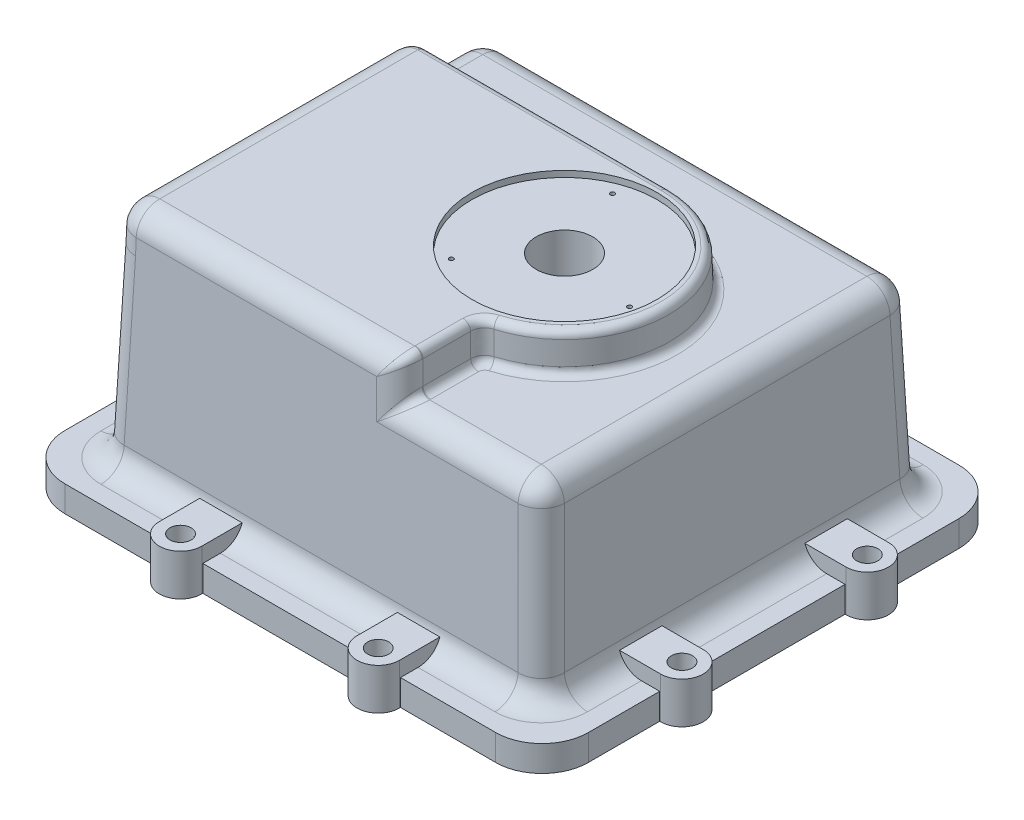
SolidWorks part; units mm, degrees
ref_plane "Front Plane" through (0, 0, 0) normal (0, 0, 1) x (1, 0, 0)
ref_plane "Bottom Plane" through (0, 0, 0) normal (0, 1, 0) x (1, 0, 0)
ref_plane "Right Plane" through (0, 0, 0) normal (1, 0, 0) x (0, 0, -1)
ref_plane "Top Plane" through (0, 109.9058, 0) normal (0, 1, 0) x (-1, 0, 0)
sketch "Sketch1" plane through (0, 0, 0) normal (0, 1, 0) x (1, 0, 0)
  line L0 (0, -56.5506) -> (0, 56.5506) construction
  line L1 (-91.1885, 79.1743) -> (91.1885, 79.1743)
  line L2 (-91.1885, 79.1743) -> (-91.1885, -79.1743)
  line L3 (-91.1885, -79.1743) -> (91.1885, -79.1743)
  line L4 (91.1885, 79.1743) -> (91.1885, -79.1743)
  line L5 (0, 125.2267) -> (0, -103.1293) construction
  line L6 (-125.0717, 0) -> (114.8319, 0) construction
  line L7 (-56.5506, 0) -> (56.5506, 0) construction
  point P12 (0, 79.1743)
  point P13 (-91.1885, 0)
  dimension "D1" = 182.3771
  dimension "D2" = 158.3487
extrude "BODY EXTRUDE" add sketch "Sketch1" along normal blind 87.249 draft 2
sketch "Sketch2" plane through (0, 0, 0) normal (0, 1, 0) x (1, 0, 0)
  line L0 (0, -110.293) -> (0, 116.7303) construction
  line L1 (-88.519, -95.2246) -> (88.519, -95.2246)
  line L2 (-107.569, -76.1746) -> (-107.569, 76.1746)
  line L3 (-88.519, 95.2246) -> (88.519, 95.2246)
  line L4 (107.569, -76.1746) -> (107.569, 76.1746)
  line L5 (0, 0) -> (131.7508, 0) construction
  arc A0 (-88.519, -95.2246) -> (-107.569, -76.1746) centre (-88.519, -76.1746) cw
  arc A1 (107.569, -76.1746) -> (88.519, -95.2246) centre (88.519, -76.1746) cw
  arc A2 (88.519, 95.2246) -> (107.569, 76.1746) centre (88.519, 76.1746) cw
  arc A3 (-88.519, 95.2246) -> (-107.569, 76.1746) centre (-88.519, 76.1746) ccw
  point P8 (0, -95.2246)
  point P9 (107.569, 0)
  point P12 (-107.569, -95.2246)
  point P15 (107.569, -95.2246)
  point P18 (107.569, 95.2246)
  dimension "D3" = 19.05
  dimension "D1" = 190.4492
  dimension "D2" = 215.138
extrude "FLANGE" add sketch "Sketch2" along normal blind 10.668
sketch "Sketch5" plane through (0, 0, 0) normal (0, 1, 0) x (1, 0, 0)
  line L0 (0, -104.783) -> (0, 106.1766) construction
  line L1 (-87.63, -75.6158) -> (87.63, -75.6158)
  line L2 (-87.63, -75.6158) -> (-87.63, 75.6158)
  line L3 (-87.63, 75.6158) -> (87.63, 75.6158)
  line L4 (87.63, -75.6158) -> (87.63, 75.6158)
  line L5 (-126.5949, 0) -> (121.2489, 0) construction
  point P8 (87.63, 0)
  point P9 (0, -75.6158)
  dimension "D1" = 87.63
  dimension "D2" = 75.6158
extrude "BODY CUT" cut sketch "Sketch5" along normal blind 87.249 draft 2
ref_plane "SIDE TABS TOP" through (0, 17.018, 0) normal (0, 1, 0) x (-1, 0, 0)
sketch "Sketch6" plane through (0, 17.018, 0) normal (0, 1, 0) x (-1, 0, 0)
  line L0 (0, -106.8616) -> (0, 104.3878) construction
  line L1 (122.9016, 0) -> (-124.8649, 0) construction
  line L3 (49.3776, -77.6478) -> (31.9024, -77.6478)
  line L4 (49.3776, -95.631) -> (49.3776, -77.6478)
  line L5 (31.9024, -95.631) -> (31.9024, -77.6478)
  line L6 (-49.3776, -77.6478) -> (-31.9024, -77.6478)
  line L7 (-31.9024, -95.631) -> (-31.9024, -77.6478)
  line L8 (-49.3776, -95.631) -> (-49.3776, -77.6478)
  line L9 (-31.9024, 95.631) -> (-31.9024, 77.6478)
  line L10 (-49.3776, 95.631) -> (-49.3776, 77.6478)
  line L11 (-49.3776, 77.6478) -> (-31.9024, 77.6478)
  line L12 (49.3776, 77.6478) -> (31.9024, 77.6478)
  line L13 (49.3776, 95.631) -> (49.3776, 77.6478)
  line L14 (31.9024, 95.631) -> (31.9024, 77.6478)
  line L15 (89.9922, -46.8376) -> (89.9922, -29.3624)
  line L16 (107.9754, -29.3624) -> (89.9922, -29.3624)
  line L17 (107.9754, -46.8376) -> (89.9922, -46.8376)
  line L18 (89.9922, 46.8376) -> (89.9922, 29.3624)
  line L19 (107.9754, 29.3624) -> (89.9922, 29.3624)
  line L20 (107.9754, 46.8376) -> (89.9922, 46.8376)
  line L21 (-107.9754, 46.8376) -> (-89.9922, 46.8376)
  line L22 (-89.9922, 46.8376) -> (-89.9922, 29.3624)
  line L23 (-107.9754, 29.3624) -> (-89.9922, 29.3624)
  line L24 (-107.9754, -29.3624) -> (-89.9922, -29.3624)
  line L25 (-107.9754, -46.8376) -> (-89.9922, -46.8376)
  line L26 (-89.9922, -46.8376) -> (-89.9922, -29.3624)
  arc A0 (31.9024, -95.631) -> (49.3776, -95.631) centre (40.64, -95.631) ccw
  arc A1 (-31.9024, -95.631) -> (-49.3776, -95.631) centre (-40.64, -95.631) cw
  arc A2 (-31.9024, 95.631) -> (-49.3776, 95.631) centre (-40.64, 95.631) ccw
  arc A3 (31.9024, 95.631) -> (49.3776, 95.631) centre (40.64, 95.631) cw
  arc A4 (107.9754, -46.8376) -> (107.9754, -29.3624) centre (107.9754, -38.1) ccw
  arc A5 (107.9754, 46.8376) -> (107.9754, 29.3624) centre (107.9754, 38.1) cw
  arc A6 (-107.9754, 46.8376) -> (-107.9754, 29.3624) centre (-107.9754, 38.1) ccw
  arc A7 (-107.9754, -46.8376) -> (-107.9754, -29.3624) centre (-107.9754, -38.1) cw
  dimension "D1" = 17.4752
  dimension "D5" = 107.9754
  dimension "D2" = 40.64
  dimension "D3" = 95.631
  dimension "D4" = 17.9832
  dimension "D6" = 38.1
  dimension "D7" = 17.9832
extrude "SIDE TABS" add sketch "Sketch6" against normal blind 17.018
sketch "Sketch7" plane through (0, 17.018, 0) normal (0, 1, 0) x (-1, 0, 0)
  circle A0 centre (40.64, -95.631) radius 4.3561
  arc A1 (31.9024, -95.631) -> (49.3776, -95.631) centre (40.64, -95.631) ccw construction
  circle A2 centre (107.9754, -38.1) radius 4.3561
  circle A3 centre (107.9754, 38.1) radius 4.3561
  circle A4 centre (40.64, 95.631) radius 4.3561
  circle A5 centre (-40.64, 95.631) radius 4.3561
  circle A6 centre (-107.9754, 38.1) radius 4.3561
  circle A7 centre (-107.9754, -38.1) radius 4.3561
  circle A8 centre (-40.64, -95.631) radius 4.3561
  arc A9 (-49.3776, -95.631) -> (-31.9024, -95.631) centre (-40.64, -95.631) ccw construction
  arc A10 (107.9754, -46.8376) -> (107.9754, -29.3624) centre (107.9754, -38.1) ccw construction
  arc A11 (107.9754, 29.3624) -> (107.9754, 46.8376) centre (107.9754, 38.1) ccw construction
  arc A12 (49.3776, 95.631) -> (31.9024, 95.631) centre (40.64, 95.631) ccw construction
  arc A13 (-31.9024, 95.631) -> (-49.3776, 95.631) centre (-40.64, 95.631) ccw construction
  arc A14 (-107.9754, -29.3624) -> (-107.9754, -46.8376) centre (-107.9754, -38.1) ccw construction
  arc A15 (-107.9754, 46.8376) -> (-107.9754, 29.3624) centre (-107.9754, 38.1) ccw construction
  dimension "D1" = 8.7122
extrude "SIDE TABE THRU HOLES" cut sketch "Sketch7" against normal blind 17.018 draft 0.513
fillet ".575 FILLET" radius 14.605 4 edges at (86.1066, 43.6245, 74.0924) (-86.1066, 43.6245, 74.0924) (-86.1066, 43.6245, -74.0924) (86.1066, 43.6245, -74.0924)
fillet ".375 FILLET" radius 9.525 4 edges at (-89.4789, 48.9585, 77.4647) (89.4789, 48.9585, 77.4647) (89.4789, 48.9585, -77.4647) (-89.4789, 48.9585, -77.4647)
sketch "Sketch9" plane through (0, 87.249, 0) normal (0, 1, 0) x (-1, 0, 0)
  line L0 (-88.1417, 66.6083) -> (-88.1417, -66.6083) construction
  line L1 (78.6225, 76.1275) -> (-78.6225, 76.1275) construction
  line L2 (-78.6225, -76.1275) -> (78.6225, -76.1275) construction
  line L3 (88.1417, -66.6083) -> (88.1417, 66.6083) construction
  line L4 (-88.1417, 66.6083) -> (-88.1417, -66.6083)
  line L5 (78.6225, 76.1275) -> (-78.6225, 76.1275)
  line L6 (-78.6225, -76.1275) -> (78.6225, -76.1275)
  line L7 (88.1417, -66.6083) -> (88.1417, 66.6083)
  ellipse E0 centre (-78.6109, -66.5967) end of major axis (-85.3543, -73.3401) minor radius 9.525 (-88.1417, -66.6083) -> (-78.6225, -76.1275) ccw construction
  ellipse E1 centre (78.6109, 66.5967) end of major axis (85.3543, 73.3401) minor radius 9.525 (88.1417, 66.6083) -> (78.6225, 76.1275) ccw construction
  ellipse E2 centre (78.6109, -66.5967) end of major axis (85.3543, -73.3401) minor radius 9.525 (78.6225, -76.1275) -> (88.1417, -66.6083) ccw construction
  ellipse E3 centre (-78.6109, -66.5967) end of major axis (-85.3543, -73.3401) minor radius 9.525 (-88.1417, -66.6083) -> (-78.6225, -76.1275) ccw
  ellipse E4 centre (78.6109, 66.5967) end of major axis (85.3543, 73.3401) minor radius 9.525 (88.1417, 66.6083) -> (78.6225, 76.1275) ccw
  ellipse E5 centre (78.6109, -66.5967) end of major axis (85.3543, -73.3401) minor radius 9.525 (78.6225, -76.1275) -> (88.1417, -66.6083) ccw
  ellipse E6 centre (-78.6109, 66.5967) end of major axis (-85.3543, 73.3401) minor radius 9.525 (-78.6225, 76.1275) -> (-88.1417, 66.6083) ccw construction
  ellipse E7 centre (-78.6109, 66.5967) end of major axis (-85.3543, 73.3401) minor radius 9.525 (-78.6225, 76.1275) -> (-88.1417, 66.6083) ccw
extrude "Extrude5" add sketch "Sketch9" against normal blind 3.556 draft 2
fillet "Fillet1" radius 14.605 8 edges at (80.4334, 83.693, 68.4192) (84.7074, 83.693, 0) (80.4334, 83.693, -68.4192) (0, 83.693, -72.6932) (-80.4334, 83.693, -68.4192) (-84.7074, 83.693, 0) (-80.4334, 83.693, 68.4192) (0, 83.693, 72.6932)
sketch "Sketch10" plane through (0, 87.249, 0) normal (0, 1, 0) x (1, 0, 0)
  line L0 (-88.1417, 66.6083) -> (-88.1417, -66.6083) construction
  line L1 (-78.6225, -76.1275) -> (78.6225, -76.1275) construction
  line L2 (107.569, -29.3624) -> (107.569, 29.3624) construction
  line L3 (-88.1417, 43.2853) -> (-88.1417, -66.6083)
  line L4 (-78.6225, -76.1275) -> (30.0228, -76.1275)
  line L6 (-88.1417, 43.2853) -> (21.5811, 43.2853)
  line L7 (30.0228, -42.4633) -> (30.0228, -76.1275)
  line L8 (31.9024, 95.2246) -> (-31.9024, 95.2246) construction
  line L9 (107.569, -76.1746) -> (107.569, -46.8376) construction
  arc A0 (30.0228, -42.4633) -> (21.5811, 43.2853) centre (21.5811, -0.0045) ccw
  ellipse E4 centre (-78.6109, -66.5967) end of major axis (-85.3543, -73.3401) minor radius 9.525 (-88.1417, -66.6083) -> (-87.4174, -70.2521) ccw construction
  ellipse E5 centre (-78.6109, -66.5967) end of major axis (-85.3543, -73.3401) minor radius 9.525 (-87.4174, -70.2521) -> (-85.3543, -73.3401) ccw construction
  ellipse E6 centre (-78.6109, -66.5967) end of major axis (-85.3543, -73.3401) minor radius 9.525 (-85.3543, -73.3401) -> (-82.2663, -75.4032) ccw construction
  ellipse E7 centre (-78.6109, -66.5967) end of major axis (-85.3543, -73.3401) minor radius 9.525 (-82.2663, -75.4032) -> (-78.6225, -76.1275) ccw construction
  ellipse E12 centre (-78.6109, -66.5967) end of major axis (-85.3543, -73.3401) minor radius 9.525 (-88.1417, -66.6083) -> (-87.4174, -70.2521) ccw
  ellipse E13 centre (-78.6109, -66.5967) end of major axis (-85.3543, -73.3401) minor radius 9.525 (-87.4174, -70.2521) -> (-85.3543, -73.3401) ccw
  ellipse E14 centre (-78.6109, -66.5967) end of major axis (-85.3543, -73.3401) minor radius 9.525 (-85.3543, -73.3401) -> (-82.2663, -75.4032) ccw
  ellipse E15 centre (-78.6109, -66.5967) end of major axis (-85.3543, -73.3401) minor radius 9.525 (-82.2663, -75.4032) -> (-78.6225, -76.1275) ccw
  dimension "D1" = 86.5797
  dimension "D2" = 51.9393
  dimension "D4" = 85.9879
  dimension "D3" = 77.5462
extrude "Extrude6" add sketch "Sketch10" along normal blind 15.5702 draft 2
fillet "Fillet3" radius 5.7658 1 edges
fillet "Fillet9" radius 9.525 27 edges at (-87.598, 102.8192, 11.9334) (-85.633, 102.8192, 72.2139) (-24.5717, 102.8192, 75.5838)
fillet "Fillet10" radius 3.175 16 edges at (27.2143, 84.5757, 73.546) (30.0214, 87.249, 66.7689) (-85.5602, 84.5757, -40.4769) (-78.7831, 87.249, -43.284) (29.4777, 102.8192, 66.2251) (-78.2393, 102.8192, -42.7403) (64.4048, 87.249, -6.3314) (31.0363, 87.249, 43.6908) (-85.0164, 100.1459, -39.9332) (-28.2488, 102.8192, -42.7416) (63.8926, 102.8192, -6.0761) (30.7418, 102.8192, 42.9497) (26.6706, 100.1459, 73.0022) (29.4791, 102.8192, 56.3072)
fillet "Fillet11" radius 9.525 8 edges at (-65.3372, 10.668, -78.8018) (90.816, 10.668, 58.0601) (88.0286, 10.668, -76.0144) (88.0286, 10.668, 76.0144) (-65.3372, 10.668, 78.8018) (-88.0286, 10.668, -76.0144) (-88.0286, 10.668, 76.0144) (-90.816, 10.668, 58.0601)
sketch "Sketch11" plane through (0, 102.8192, 0) normal (0, 1, 0) x (1, 0, 0)
  circle A0 centre (21.5811, -0.0045) radius 38.1
  dimension "D1" = 76.2
extrude "Cut-Extrude1" cut sketch "Sketch11" against normal blind 2.54
sketch "Sketch12" plane through (0, 100.2792, 0) normal (0, 1, 0) x (1, 0, 0)
  line L0 (21.5811, -0.0045) -> (21.5811, 26.3661) construction
  line L1 (21.5811, -0.0045) -> (10.2876, 31.0242) construction
  line L2 (21.5811, -0.0045) -> (0.3563, -25.2993) construction
  line L3 (21.5811, -0.0045) -> (54.0995, -5.7384) construction
  circle A0 centre (21.5811, -0.0045) radius 11.6332
  circle A1 centre (10.2876, 31.0242) radius 0.889
  circle A2 centre (54.0995, -5.7384) radius 0.889
  circle A3 centre (0.3563, -25.2993) radius 0.889
  circle A4 centre (21.5811, -0.0045) radius 33.02 construction
  dimension "D1" = 23.2664
  dimension "D5" = 66.04
  dimension "D6" = 1.778
  dimension "D2" = 20
  dimension "D3" = 120
  dimension "D4" = 120
extrude "Cut-Extrude2" cut sketch "Sketch12" against normal through all
